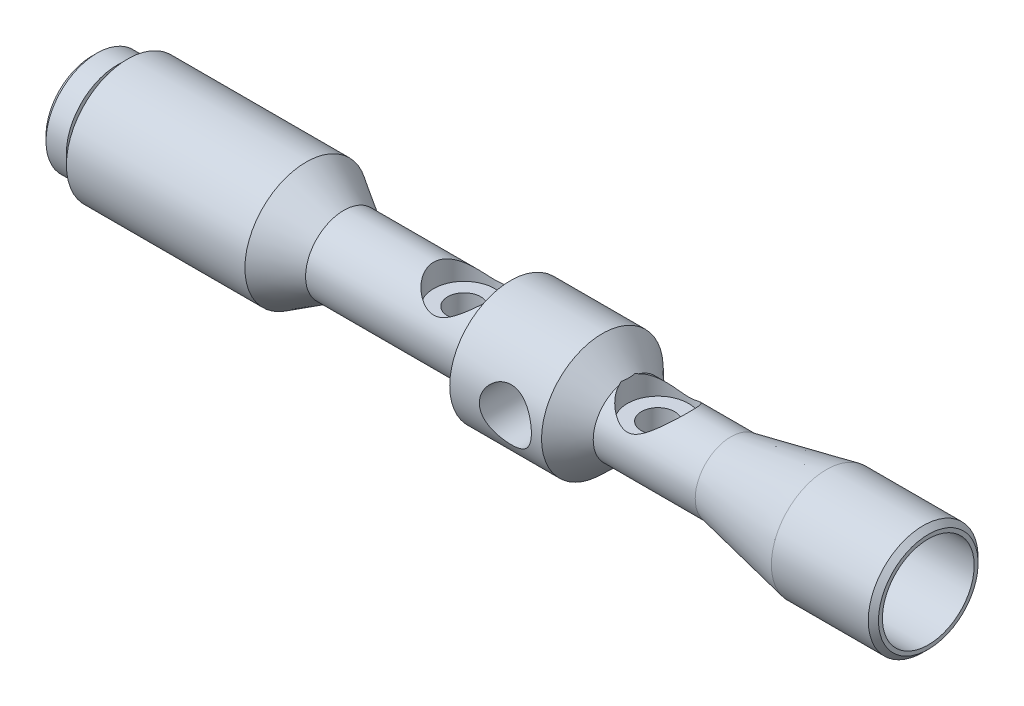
SolidWorks part; units mm, degrees
ref_plane "前视基准面" through (0, 0, 0) normal (0, 0, 1) x (1, 0, 0)
ref_plane "上视基准面" through (0, 0, 0) normal (0, 1, 0) x (1, 0, 0)
ref_plane "右视基准面" through (0, 0, 0) normal (1, 0, 0) x (0, 0, -1)
sketch "草图1" plane through (0, 0, 0) normal (0, 1, 0) x (1, 0, 0)
  line L0 (-47.3416, 0) -> (48.5246, 0) construction
  line L1 (-61.4329, 0) -> (-61.4329, 10)
  line L2 (-61.4329, 10) -> (-56.4329, 10)
  line L3 (-56.4329, 10) -> (-56.4329, 8.5)
  line L4 (-56.4329, 8.5) -> (-54.4329, 8.5)
  line L5 (-54.4329, 8.5) -> (-54.4329, 12)
  line L6 (-54.4329, 12) -> (-19.4329, 12)
  line L7 (-19.4329, 12) -> (-12.0371, 7.5)
  line L8 (-12.0371, 7.5) -> (17.9671, 7.5)
  line L9 (17.9671, 7.5) -> (20.662, 11.9292)
  line L10 (20.662, 11.9292) -> (38.662, 11.9292)
  line L11 (38.662, 11.9292) -> (43.8671, 7)
  line L12 (43.8671, 7) -> (63.8671, 7)
  line L13 (63.8671, 7) -> (82.5671, 10.7677)
  line L14 (82.5671, 10.7677) -> (102.5671, 10.7677)
  line L15 (102.5671, 10.7677) -> (102.5671, 0)
  line L16 (102.5671, 0) -> (-61.4329, 0)
  dimension "D1" = 10
  dimension "D2" = 8.5
  dimension "D3" = 12
  dimension "D4" = 7.5
  dimension "D5" = 7
  dimension "D6" = 5
  dimension "D7" = 2
  dimension "D8" = 42
  dimension "D9" = 7.3958
  dimension "D10" = 164
  dimension "D11" = 20
  dimension "D12" = 18.7
  dimension "D13" = 20
  dimension "D14" = 25.9
  dimension "D15" = 18
revolve "旋转1" add sketch "草图1" angle 360 about L0
hole_wizard "孔1" positions "草图2" profile "草图4" legacy
sketch "草图2" plane through (-61.4329, 0, 0) normal (-1, 0, 0) x (0, 0, 1)
  point P0 (0, 0)
sketch "草图4" plane through (-61.4329, 0, 0) normal (0, 1, 0) x (0, 0, 1)
  line L0 (0, 0) -> (0, 53.0043)
  line L1 (0, 53.0043) -> (5, 50)
  line L2 (5, 50) -> (5, 20)
  line L3 (5, 20) -> (7, 20)
  line L4 (7, 0) -> (0, 0)
  line L5 (0, -11.3109) -> (0, 121.1557) construction
  line L6 (0, 53.0043) -> (-5, 50) construction
  line L7 (7, 20) -> (7, 0)
  dimension "直径" = 10
  dimension "深度" = 50
  dimension "柱坑直径" = 14
  dimension "柱坑深度" = 20
  dimension "导头角度" = 118
hole_wizard "孔3" positions "草图8" profile "草图9" legacy
sketch "草图8" plane through (102.5671, 0, 0) normal (1, 0, 0) x (0, 0, -1)
  point P0 (0, 0)
sketch "草图9" plane through (102.5671, 0, 0) normal (0, 1, 0) x (0, 0, -1)
  line L0 (0, 0) -> (0, 43.0043)
  line L1 (0, 43.0043) -> (5, 40)
  line L2 (5, 40) -> (5, 20)
  line L3 (5, 20) -> (9, 20)
  line L4 (9, 0) -> (0, 0)
  line L5 (0, -11.3109) -> (0, 121.1557) construction
  line L6 (0, 43.0043) -> (-5, 40) construction
  line L7 (9, 20) -> (9, 0)
  dimension "直径" = 10
  dimension "深度" = 40
  dimension "柱坑直径" = 18
  dimension "柱坑深度" = 20
  dimension "导头角度" = 118
chamfer "倒角3" distance 1 angle 45 1 edges at (102.5671, 0, 10.7677)
hole_wizard "孔7" positions "3D草图1" profile "草图12" legacy
sketch3d "3D草图1"
  point P0 (11.5704, 7.5, 0)
  point P4 (49.5671, 7, 0)
  dimension "D1" = 38
sketch "草图12" plane through (11.5704, 7.5, 0) normal (1, 0, 0) x (0, 0, 1)
  line L0 (0, 0) -> (0, 50)
  line L1 (0, 50) -> (3.25, 50)
  line L2 (3.25, 50) -> (3.25, 4.5)
  line L3 (3.25, 4.5) -> (6, 4.5)
  line L4 (6, 4.5) -> (6, 0)
  line L5 (6, 0) -> (0, 0)
  line L6 (0, 110) -> (0, -10) construction
  dimension "直径" = 6.5
  dimension "深度" = 50
  dimension "柱坑直径" = 12
  dimension "柱坑深度" = 4.5
hole_wizard "M12 螺纹孔1" positions "3D草图2" profile "草图14" tap size "M12" standard "GB"
sketch3d "3D草图2"
  line L6 (101.5671, 0, 0) -> (102.5671, 0, 0) construction
  line L9 (102.5671, 0, 0) -> (102.5671, 54.6951, 0) construction
  line L11 (102.5671, 0, 0) -> (102.5671, 0, 66.0018) construction
  point P0 (-258.4278, 87.7583, 0)
  point P2 (31.5671, 0, 11.9292)
  dimension "D1" = 71
sketch "草图14" plane through (31.5671, 0, 11.9292) normal (1, 0, 0) x (0, -1, 0)
  line L0 (0, 0) -> (0, 18.3144)
  line L1 (0, 18.3144) -> (5.1, 15.25)
  line L2 (5.1, 15.25) -> (5.1, 0)
  line L5 (5.1, 0) -> (0, 0)
  line L10 (0, 18.3144) -> (-5.1, 15.25) construction
  line L11 (0, -6.35) -> (0, 107.95) construction
  dimension "螺纹孔钻头直径" = 10.2
  dimension "螺纹孔钻头深度" = 15.25
  dimension "导头角度" = 118
chamfer "倒角4" distance 1 angle 45 1 edges at (-61.4329, 0, 10)
